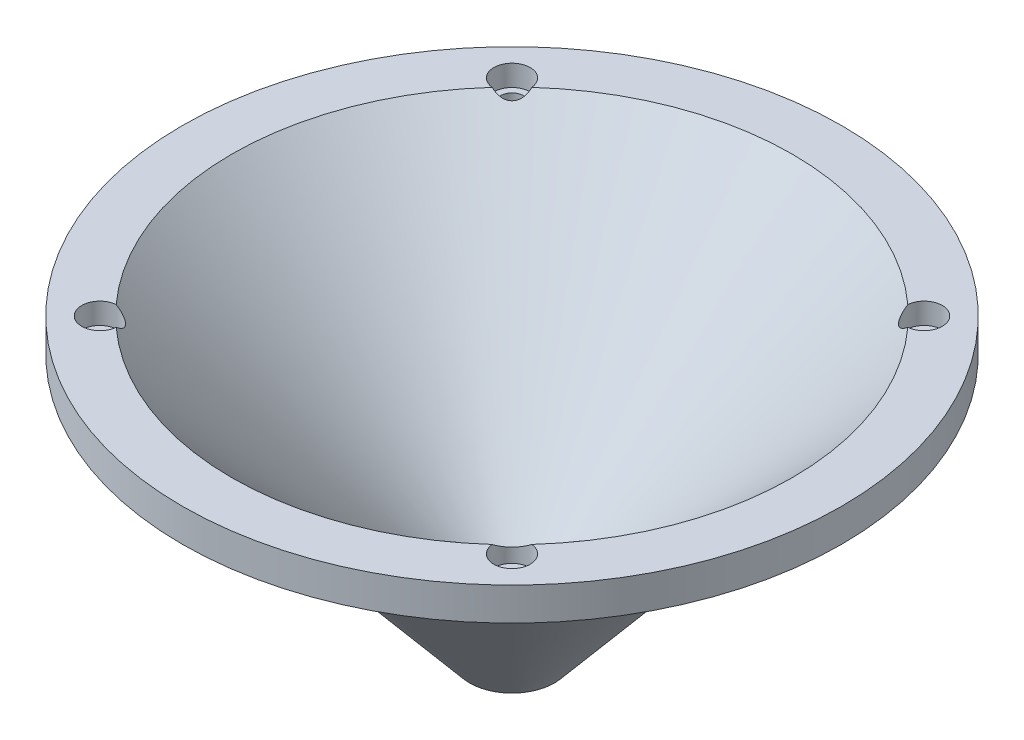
SolidWorks part; units mm, degrees
ref_plane "Front" through (0, 0, 0) normal (0, 0, 1) x (1, 0, 0)
ref_plane "Top" through (0, 0, 0) normal (0, 1, 0) x (1, 0, 0)
ref_plane "Right" through (0, 0, 0) normal (1, 0, 0) x (0, 0, -1)
sketch "Sketch1" plane through (0, 0, 0) normal (0, 1, 0) x (1, 0, 0)
  circle A0 centre (0, 0) radius 100
  dimension "D1" = 200
extrude "Boss-Extrude1" add sketch "Sketch1" against normal blind 10
sketch "Sketch2" plane through (0, -10, 0) normal (0, -1, 0) x (1, 0, 0)
  circle A0 centre (0, 0) radius 80
  dimension "D1" = 160
extrude "Boss-Extrude2" add sketch "Sketch2" along normal blind 80
sketch "Sketch3" plane through (0, 0, 0) normal (0, 1, 0) x (1, 0, 0)
  circle A0 centre (0, 0) radius 5
extrude "Cut-Extrude4" cut sketch "Sketch3" against normal through all
sketch "Sketch7" plane through (0, 0, 0) normal (0, 1, 0) x (1, 0, 0)
  line L1 (62.5, -62.5) -> (-62.5, -62.5) construction
  line L2 (62.5, -62.5) -> (62.5, 62.5) construction
  line L3 (62.5, 62.5) -> (-62.5, 62.5) construction
  line L4 (-62.5, -62.5) -> (-62.5, 62.5) construction
  line L5 (62.5, -62.5) -> (-62.5, 62.5) construction
  line L6 (62.5, 62.5) -> (-62.5, -62.5) construction
  point P0 (0, 0)
  dimension "D1" = 125
  dimension "D2" = 125
hole_wizard "CBORE for M6 Socket Head Cap Screw1" positions "Sketch9" profile "Sketch10" counterbore size "M6" standard "DIN"
sketch "Sketch9" plane through (0, 0, 0) normal (0, 1, 0) x (1, 0, 0)
  point P0 (62.5, -62.5)
  point P3 (-62.5, -62.5)
  point P6 (-62.5, 62.5)
  point P9 (62.5, 62.5)
sketch "Sketch10" plane through (62.5, 0, 62.5) normal (1, 0, 0) x (0, 0, 1)
  line L0 (0, 0) -> (0, 90)
  line L1 (0, 90) -> (3.5, 90)
  line L3 (3.5, 90) -> (3.5, 6.4)
  line L4 (3.5, 6.4) -> (5.5, 6.4)
  line L5 (5.5, 6.4) -> (5.5, 0)
  line L7 (5.5, 0) -> (0, 0)
  line L11 (0, -6.35) -> (0, 107.95) construction
  dimension "Thru Hole Dia." = 7
  dimension "Thru Hole Depth" = 90
  dimension "C'Bore Dia." = 11
  dimension "C'Bore Depth" = 6.4
chamfer "Chamfer1" distance 80 angle 45 1 edges at (0, 0, 5)
chamfer "Chamfer2" distance 80 angle 40 1 edges at (0, -90, -80)
